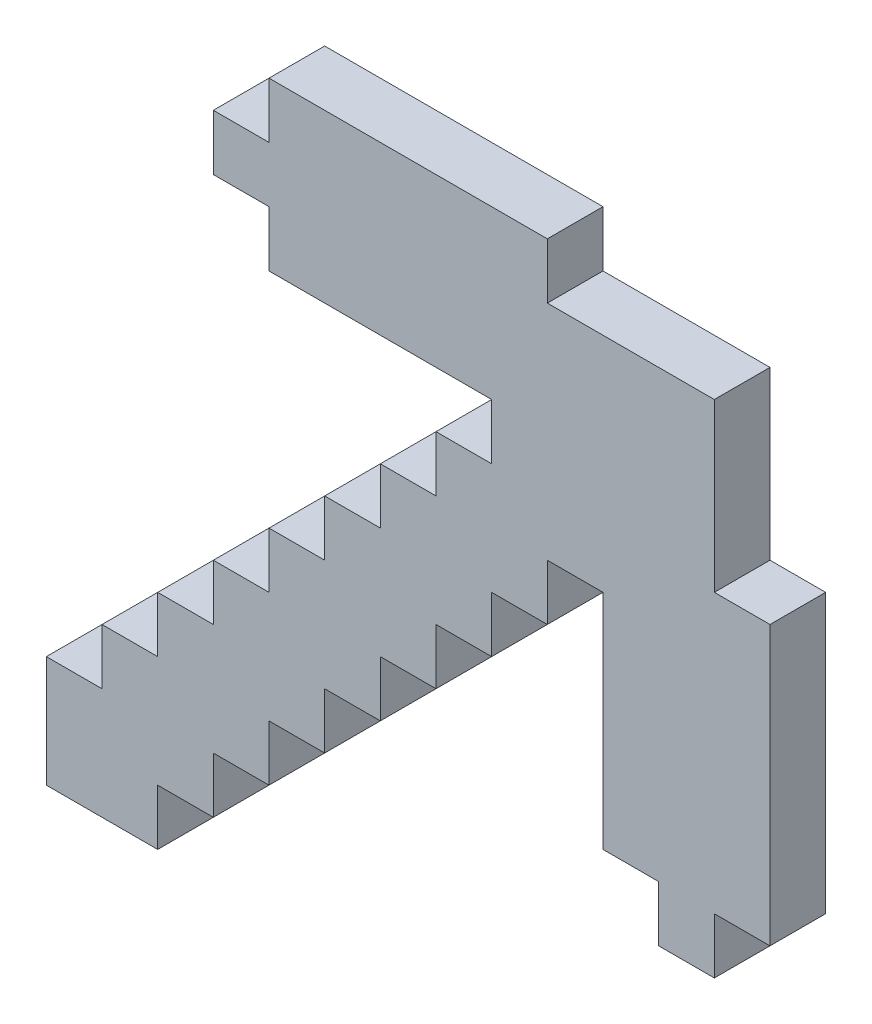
SolidWorks part; units mm, degrees
ref_plane "Front Plane" through (0, 0, 0) normal (0, 0, 1) x (1, 0, 0)
ref_plane "Top Plane" through (0, 0, 0) normal (0, 1, 0) x (1, 0, 0)
ref_plane "Right Plane" through (0, 0, 0) normal (1, 0, 0) x (0, 0, -1)
sketch "Sketch1" plane through (0, 0, 0) normal (0, 0, 1) x (1, 0, 0)
  line L0 (0, 0) -> (9.525, 0)
  line L1 (9.525, 0) -> (9.525, 4.7625)
  line L2 (47.625, 38.1) -> (47.625, 19.05)
  line L3 (47.625, 19.05) -> (52.3875, 19.05)
  line L4 (52.3875, 19.05) -> (52.3875, 14.2875)
  line L5 (52.3875, 14.2875) -> (57.15, 14.2875)
  line L6 (57.15, 14.2875) -> (57.15, 19.05)
  line L7 (42.8625, 38.1) -> (47.625, 38.1)
  line L8 (57.15, 19.05) -> (61.9125, 19.05)
  line L9 (9.525, 4.7625) -> (14.2875, 4.7625)
  line L10 (14.2875, 4.7625) -> (14.2875, 9.525)
  line L11 (14.2875, 9.525) -> (19.05, 9.525)
  line L12 (19.05, 9.525) -> (19.05, 14.2875)
  line L13 (19.05, 14.2875) -> (23.8125, 14.2875)
  line L14 (23.8125, 14.2875) -> (23.8125, 19.05)
  line L15 (0, 0) -> (57.15, 57.15) construction
  line L16 (23.8125, 19.05) -> (28.575, 19.05)
  line L17 (28.575, 19.05) -> (28.575, 23.8125)
  line L18 (28.575, 23.8125) -> (33.3375, 23.8125)
  line L19 (33.3375, 23.8125) -> (33.3375, 28.575)
  line L20 (33.3375, 28.575) -> (38.1, 28.575)
  line L21 (38.1, 28.575) -> (38.1, 33.3375)
  line L22 (38.1, 33.3375) -> (42.8625, 33.3375)
  line L23 (42.8625, 33.3375) -> (42.8625, 38.1)
  line L24 (61.9125, 19.05) -> (61.9125, 42.8625)
  line L25 (61.9125, 42.8625) -> (57.15, 42.8625)
  line L26 (57.15, 42.8625) -> (57.15, 57.15)
  line L27 (42.8625, 57.15) -> (57.15, 57.15)
  line L28 (42.8625, 61.9125) -> (42.8625, 57.15)
  line L29 (19.05, 61.9125) -> (42.8625, 61.9125)
  line L30 (33.3375, 42.8625) -> (38.1, 42.8625)
  line L31 (33.3375, 38.1) -> (33.3375, 42.8625)
  line L32 (28.575, 38.1) -> (33.3375, 38.1)
  line L33 (28.575, 33.3375) -> (28.575, 38.1)
  line L34 (23.8125, 33.3375) -> (28.575, 33.3375)
  line L35 (23.8125, 28.575) -> (23.8125, 33.3375)
  line L36 (19.05, 28.575) -> (23.8125, 28.575)
  line L37 (19.05, 23.8125) -> (19.05, 28.575)
  line L38 (14.2875, 23.8125) -> (19.05, 23.8125)
  line L39 (14.2875, 19.05) -> (14.2875, 23.8125)
  line L40 (9.525, 19.05) -> (14.2875, 19.05)
  line L41 (9.525, 14.2875) -> (9.525, 19.05)
  line L42 (4.7625, 14.2875) -> (9.525, 14.2875)
  line L43 (4.7625, 9.525) -> (4.7625, 14.2875)
  line L44 (19.05, 57.15) -> (19.05, 61.9125)
  line L45 (38.1, 42.8625) -> (38.1, 47.625)
  line L46 (14.2875, 57.15) -> (19.05, 57.15)
  line L47 (14.2875, 52.3875) -> (14.2875, 57.15)
  line L48 (19.05, 52.3875) -> (14.2875, 52.3875)
  line L49 (19.05, 47.625) -> (19.05, 52.3875)
  line L50 (38.1, 47.625) -> (19.05, 47.625)
  line L51 (0, 9.525) -> (4.7625, 9.525)
  line L52 (0, 0) -> (0, 9.525)
  dimension "D1" = 9.525
  dimension "D2" = 4.7625
  dimension "D3" = 38.1
  dimension "D4" = 23.8125
  dimension "D5" = 19.05
  dimension "D6" = 14.2875
extrude "Boss-Extrude1" add sketch "Sketch1" along normal blind 4.7625
